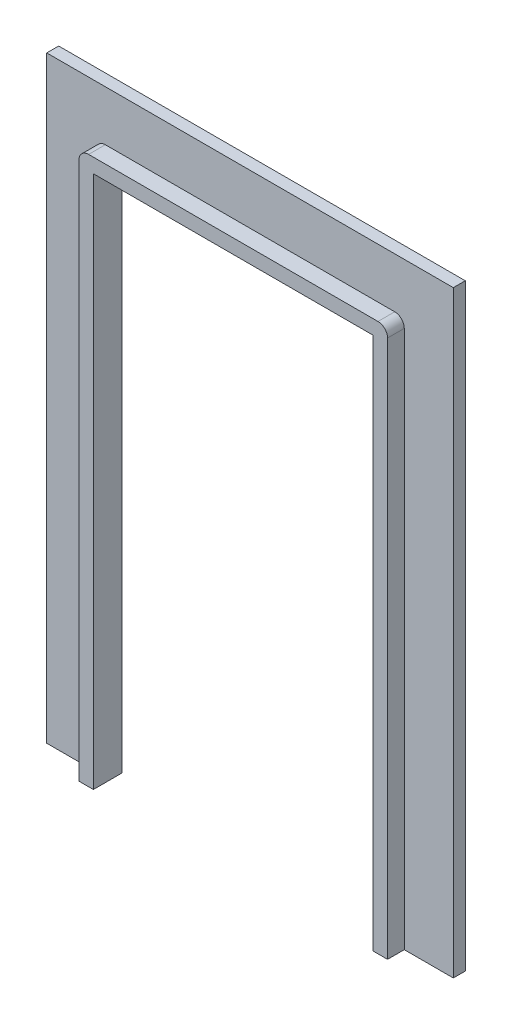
SolidWorks part; units mm, degrees
ref_plane "Plan de face" through (0, 0, 0) normal (0, 0, 1) x (1, 0, 0)
ref_plane "Plan de dessus" through (0, 0, 0) normal (0, 1, 0) x (1, 0, 0)
ref_plane "Plan de droite" through (0, 0, 0) normal (1, 0, 0) x (0, 0, -1)
sketch "Esquisse1" plane through (0, 0, 0) normal (0, 0, 1) x (1, 0, 0)
  line L1 (0, 0) -> (85, 0)
  line L2 (0, 0) -> (0, 125)
  line L3 (0, 125) -> (85, 125)
  line L4 (85, 0) -> (85, 125)
  dimension "D1" = 85
  dimension "D2" = 125
extrude "Extrusion1" add sketch "Esquisse1" along normal blind 6
sketch "Esquisse2" plane through (0, 0, 6) normal (0, 0, 1) x (1, 0, 0)
  line L0 (42.5, 125) -> (42.5, 0) construction
  line L1 (85, 125) -> (0, 125) construction
  line L2 (0, 0) -> (85, 0) construction
  line L4 (10.25, 0) -> (74.75, 0)
  line L5 (10.25, 0) -> (10.25, 112.5)
  line L6 (12.25, 114.5) -> (72.75, 114.5)
  line L7 (74.75, 0) -> (74.75, 112.5)
  arc A0 (72.75, 114.5) -> (74.75, 112.5) centre (72.75, 112.5) cw
  arc A1 (10.25, 112.5) -> (12.25, 114.5) centre (12.25, 112.5) cw
  dimension "D3" = 2
  dimension "D1" = 64.5
  dimension "D2" = 114.5
extrude "Enlèv. mat.-Extru.3" cut sketch "Esquisse2" along direction (0, 0, -1) on the side against the normal blind 3.5 flip side to cut
sketch "Esquisse4" plane through (0, 0, 6) normal (0, 0, 1) x (1, 0, 0)
  line L0 (42.5, 114.5) -> (42.5, 0) construction
  line L1 (72.75, 114.5) -> (12.25, 114.5) construction
  line L2 (10.25, 0) -> (74.75, 0) construction
  line L3 (10.25, 112.5) -> (10.25, 0) construction
  line L4 (13.25, 0) -> (71.75, 0)
  line L5 (13.25, 0) -> (13.25, 111.5)
  line L6 (13.25, 111.5) -> (71.75, 111.5)
  line L7 (71.75, 0) -> (71.75, 111.5)
  dimension "D1" = 3
  dimension "D2" = 3
extrude "Enlèv. mat.-Extru.4" cut sketch "Esquisse4" against normal through all
